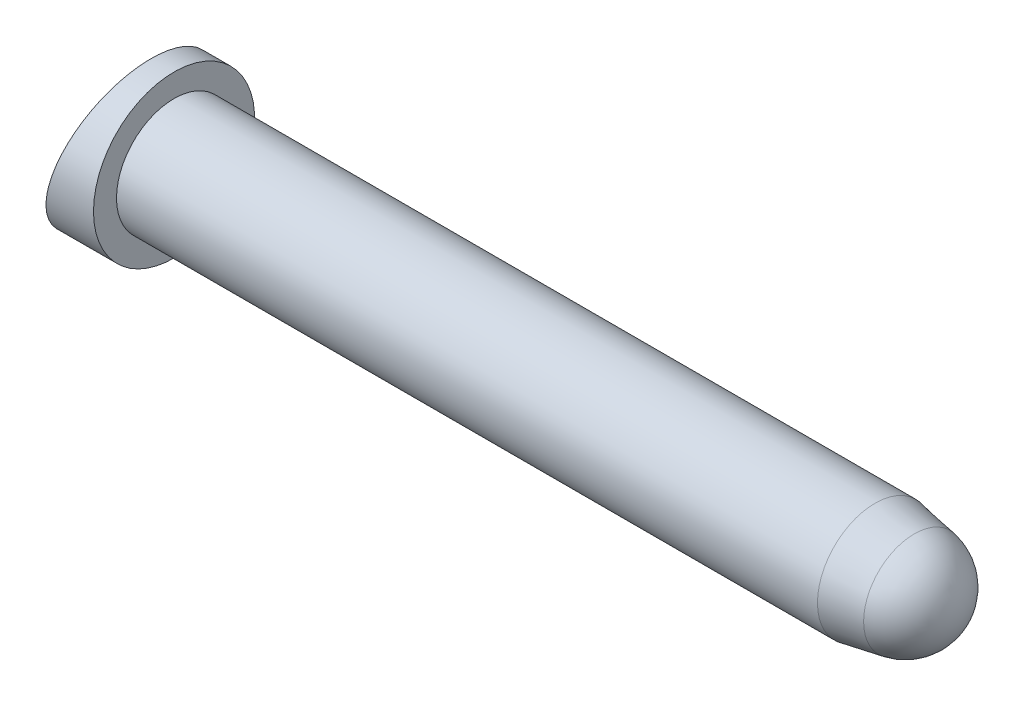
SolidWorks part; units mm, degrees
ref_plane "Face" through (0, 0, 0) normal (0, 0, 1) x (1, 0, 0)
ref_plane "Dessus" through (0, 0, 0) normal (0, 1, 0) x (1, 0, 0)
ref_plane "Droite" through (0, 0, 0) normal (1, 0, 0) x (0, 0, -1)
imported_body "Importée1"
sketch "Esquisse1" plane through (0, 0, 0) normal (0, 0, 1) x (1, 0, 0)
  line L0 (0, 0) -> (8.339, 0) construction
  line L1 (12, -7) -> (12, 7) construction
  line L2 (0, 0) -> (0, 8.7658) construction
  line L3 (10.3451, 8.3041) -> (4.9949, -11.663)
  point P3 (8.12, 0)
  dimension "D1" = 3.88
  dimension "D2" = 15
extrude "Enlèv. de mat.-Extru.-Mince1" cut sketch "Esquisse1" against normal through all and the other way through all thin
